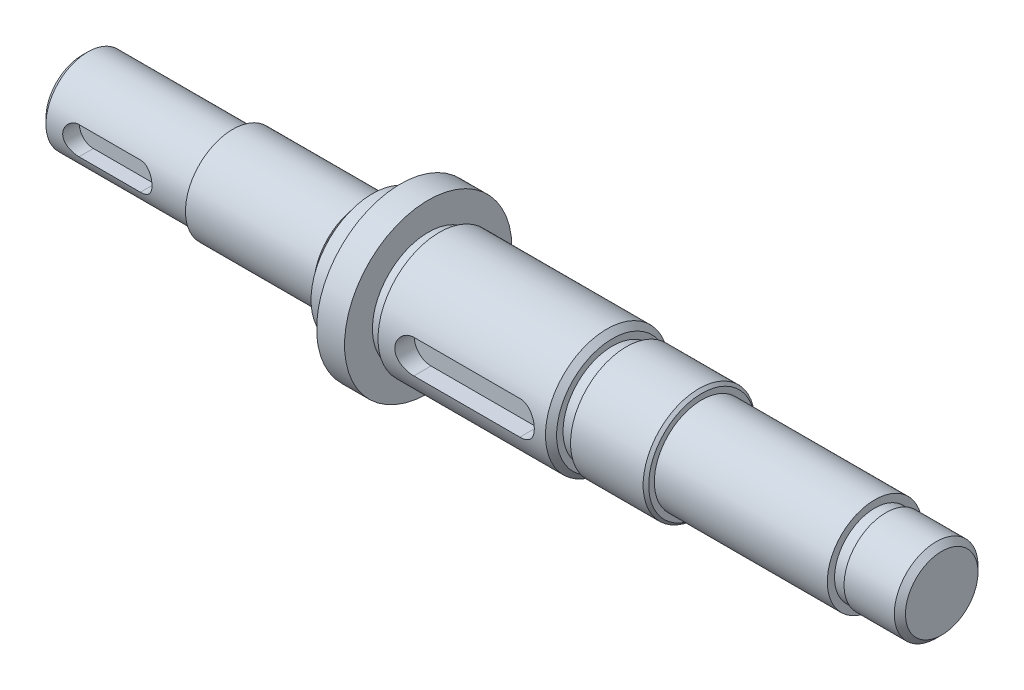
SolidWorks part; units mm, degrees
ref_plane "前视基准面" through (0, 0, 0) normal (0, 0, 1) x (1, 0, 0)
ref_plane "上视基准面" through (0, 0, 0) normal (0, 1, 0) x (1, 0, 0)
ref_plane "右视基准面" through (0, 0, 0) normal (1, 0, 0) x (0, 0, -1)
sketch "草图4" plane through (0, 0, 0) normal (1, 0, 0) x (0, 0, -1)
  circle A0 centre (0, 0) radius 7.5
extrude "拉伸1" add sketch "草图4" along normal blind 27
sketch "草图7" plane through (27, 0, 0) normal (1, 0, 0) x (0, 0, -1)
  circle A0 centre (0, 0) radius 8.5
extrude "拉伸2" add sketch "草图7" along normal blind 23
sketch "草图8" plane through (50, 0, 0) normal (1, 0, 0) x (0, 0, -1)
  circle A0 centre (0, 0) radius 8.2
extrude "拉伸3" add sketch "草图8" along normal blind 2
sketch "草图9" plane through (52, 0, 0) normal (1, 0, 0) x (0, 0, -1)
  circle A0 centre (0, 0) radius 11
extrude "拉伸4" add sketch "草图9" along normal blind 5
sketch "草图10" plane through (57, 0, 0) normal (1, 0, 0) x (0, 0, -1)
  circle A0 centre (0, 0) radius 15
extrude "拉伸5" add sketch "草图10" along normal blind 5
sketch "草图11" plane through (62, 0, 0) normal (1, 0, 0) x (0, 0, -1)
  circle A0 centre (0, 0) radius 10
extrude "拉伸6" add sketch "草图11" along normal blind 2
sketch "草图12" plane through (64, 0, 0) normal (1, 0, 0) x (0, 0, -1)
  circle A0 centre (0, 0) radius 11
extrude "拉伸7" add sketch "草图12" along normal blind 31
sketch "草图13" plane through (95, 0, 0) normal (1, 0, 0) x (0, 0, -1)
  circle A0 centre (0, 0) radius 8.85
extrude "拉伸8" add sketch "草图13" along normal blind 2.5
sketch "草图14" plane through (97.5, 0, 0) normal (1, 0, 0) x (0, 0, -1)
  circle A0 centre (0, 0) radius 10
extrude "拉伸9" add sketch "草图14" along normal blind 13.5
sketch "草图15" plane through (111, 0, 0) normal (1, 0, 0) x (0, 0, -1)
  circle A0 centre (0, 0) radius 8.5
extrude "拉伸10" add sketch "草图15" along normal blind 31
sketch "草图16" plane through (142, 0, 0) normal (1, 0, 0) x (0, 0, -1)
  circle A0 centre (0, 0) radius 7.2
extrude "拉伸11" add sketch "草图16" along normal blind 2
sketch "草图17" plane through (144, 0, 0) normal (1, 0, 0) x (0, 0, -1)
  circle A0 centre (0, 0) radius 7.5
extrude "拉伸12" add sketch "草图17" along normal blind 10
ref_plane "基准面1" through (0, 0, 7.5) normal (0, 0, 1) x (1, 0, 0)
sketch "草图18" plane through (0, 0, 7.5) normal (0, 0, 1) x (1, 0, 0)
  line L0 (6.5, 2.5) -> (17.5, 2.5)
  line L1 (6.5, -2.5) -> (17.5, -2.5)
  arc A0 (6.5, 2.5) -> (6.5, -2.5) centre (6.5, 0) ccw
  arc A1 (17.5, -2.5) -> (17.5, 2.5) centre (17.5, 0) ccw
  point P0 (6.5, 0)
  point P1 (17.5, 0)
extrude "切除-拉伸1" cut sketch "草图18" against normal blind 3
chamfer "倒角1" distance 1 distance2 1 1 edges at (0, 0, -7.5)
chamfer "倒角2" distance 1 angle 45 2 edges at (154, 0, -7.5) (95, 0, -11)
chamfer "倒角3" distance 0.5 angle 45 1 edges at (111, 0, -10)
ref_plane "基准面2" through (0, 0, 11) normal (0, 0, 1) x (1, 0, 0)
sketch "草图20" plane through (0, 0, 11) normal (0, 0, 1) x (1, 0, 0)
  line L0 (70, 3) -> (89, 3)
  line L1 (70, -3) -> (89, -3)
  arc A0 (70, 3) -> (70, -3) centre (70, 0) ccw
  arc A1 (89, -3) -> (89, 3) centre (89, 0) ccw
  point P0 (70, 0)
  point P1 (89, 0)
extrude "切除-拉伸2" cut sketch "草图20" against normal blind 3.5
